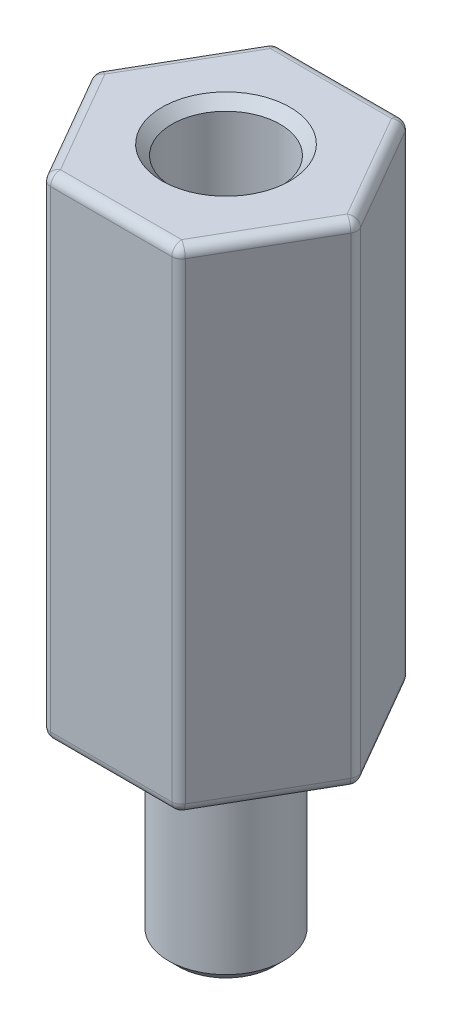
SolidWorks part; units mm, degrees
ref_plane "Front Plane" through (0, 0, 0) normal (0, 0, 1) x (1, 0, 0)
ref_plane "Top Plane" through (0, 0, 0) normal (0, 1, 0) x (1, 0, 0)
ref_plane "Right Plane" through (0, 0, 0) normal (1, 0, 0) x (0, 0, -1)
sketch "Sketch1" plane through (0, 0, 0) normal (0, 1, 0) x (1, 0, 0)
  line L1 (-2.0207, 3.5) -> (-4.0415, 0)
  line L2 (-4.0415, 0) -> (-2.0207, -3.5)
  line L3 (-2.0207, -3.5) -> (2.0207, -3.5)
  line L4 (2.0207, -3.5) -> (4.0415, 0)
  line L5 (4.0415, 0) -> (2.0207, 3.5)
  line L6 (2.0207, 3.5) -> (-2.0207, 3.5)
  circle A0 centre (0, 0) radius 3.5 construction
  circle A1 centre (0, 0) radius 1.65
  dimension "D2" = 3.3
  dimension "D1" = 7
extrude "Boss-Extrude1" add sketch "Sketch1" along normal blind 15
fillet "Fillet1" radius 0.3 6 edges at (2.0207, 7.5, -3.5) (4.0415, 7.5, 0) (-2.0207, 7.5, -3.5) (-4.0415, 7.5, 0) (-2.0207, 7.5, 3.5) (2.0207, 7.5, 3.5)
fillet "Fillet2" radius 0.3 24 edges at (-1.9975, 0, 3.4598) (-3.0311, 0, 1.75) (-3.995, 0, 0) (-3.0311, 0, -1.75) (-1.9975, 0, -3.4598) (0, 0, -3.5) (1.9975, 0, -3.4598) (3.0311, 0, -1.75) (3.995, 0, 0) (3.0311, 0, 1.75) (1.9975, 0, 3.4598) (-1.9975, 15, 3.4598) (-3.0311, 15, 1.75) (-3.995, 15, 0) (-3.0311, 15, -1.75) (-1.9975, 15, -3.4598) (0, 15, -3.5) (1.9975, 15, -3.4598) (3.0311, 15, -1.75) (3.995, 15, 0) (3.0311, 15, 1.75) (1.9975, 15, 3.4598) (0, 0, 3.5) (0, 15, 3.5)
sketch "Sketch2" plane through (0, 0, 0) normal (0, -1, 0) x (1, 0, 0)
  circle A0 centre (0, 0) radius 1.75
  dimension "D1" = 3.5
extrude "Boss-Extrude2" add sketch "Sketch2" along normal blind 6
chamfer "Chamfer1" distance 0.3 angle 45 2 edges at (0, 15, 1.65) (0, -6, -1.75)
fillet "Fillet3" radius 0.3 1 edges at (0, 0, 1.75)
